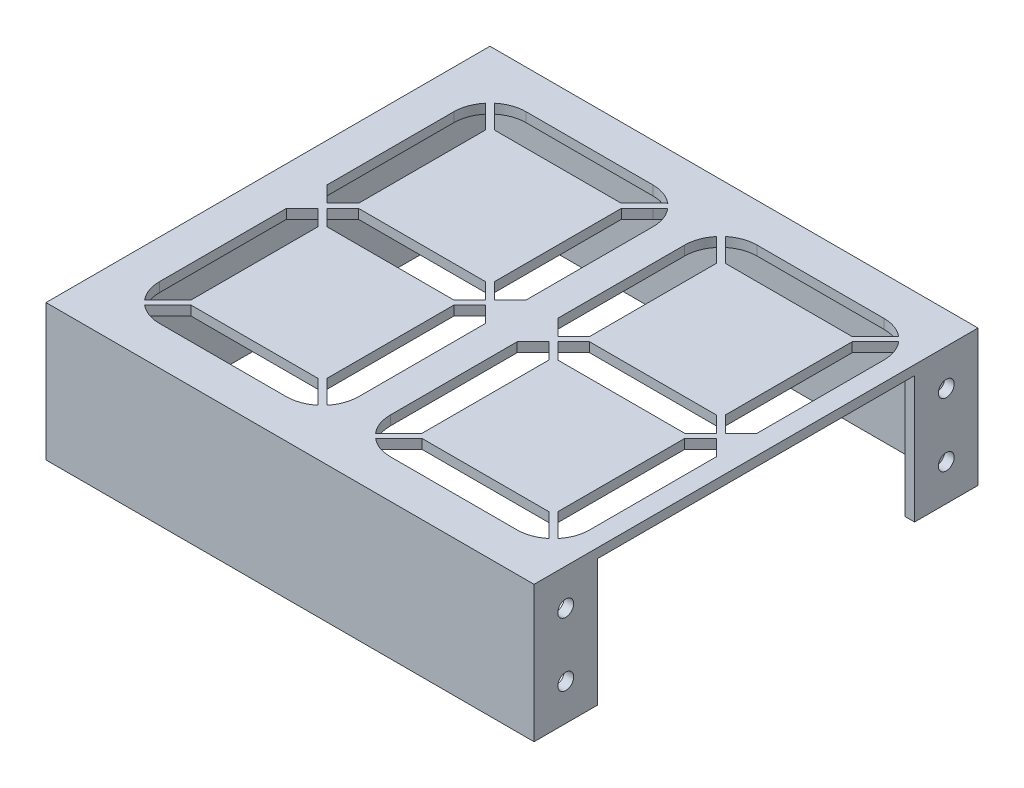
SolidWorks part; units mm, degrees
ref_plane "Alzado" through (0, 0, 0) normal (0, 0, 1) x (1, 0, 0)
ref_plane "Planta" through (0, 0, 0) normal (0, 1, 0) x (1, 0, 0)
ref_plane "Vista lateral" through (0, 0, 0) normal (1, 0, 0) x (0, 0, -1)
sketch "Croquis2" plane through (0, 0, 0) normal (0, 1, 0) x (1, 0, 0)
  line L0 (-16.41, 5) -> (-56.41, 5)
  line L2 (-11.41, 0) -> (-16.41, -5)
  line L3 (-56.41, -5) -> (-16.41, -5)
  line L4 (-16.41, 5) -> (-11.41, 0)
  line L5 (-56.41, 5) -> (-61.41, 0)
  line L6 (-61.41, 0) -> (-56.41, -5)
  line L9 (-14.9958, 6.4142) -> (-9.9958, 1.4142)
  line L11 (-4.9931, 6.41) -> (-4.9931, 46.4031)
  line L13 (-9.9958, 51.4127) -> (-14.9958, 46.4127)
  line L14 (-14.9958, 46.4127) -> (-14.9958, 6.4142)
  line L18 (-57.8242, 46.4127) -> (-57.8242, 6.4142)
  line L19 (-62.8242, 51.4127) -> (-57.8242, 46.4127)
  line L21 (-67.8235, 6.4135) -> (-67.8235, 46.4135)
  line L23 (-57.8242, 6.4142) -> (-62.8242, 1.4142)
  line L29 (-14.9958, -6.4073) -> (-9.9958, -1.4073)
  line L31 (-57.8172, -6.4142) -> (-62.8172, -1.4142)
  line L33 (-67.8165, -6.4135) -> (-67.8165, -46.4135)
  line L35 (-62.8172, -51.4127) -> (-57.8172, -46.4127)
  line L36 (-57.8172, -46.4127) -> (-57.8172, -6.4142)
  line L37 (-14.9958, -46.4058) -> (-14.9958, -6.4073)
  line L38 (-9.9958, -51.4058) -> (-14.9958, -46.4058)
  line L40 (-4.9965, -6.4135) -> (-4.9965, -46.4065)
  line L43 (-11.41, -52.82) -> (-16.41, -47.82)
  line L46 (-61.41, -52.82) -> (-56.41, -47.82)
  line L47 (-56.41, -47.82) -> (-16.41, -47.82)
  line L48 (-16.41, -57.82) -> (-56.4099, -57.82)
  line L49 (-16.4169, 47.82) -> (-11.4169, 52.82)
  line L56 (-56.4169, 47.82) -> (-61.4169, 52.82)
  line L57 (-56.4169, 57.82) -> (-16.41, 57.82)
  line L58 (-16.4169, 47.82) -> (-56.4169, 47.82)
  line L84 (-9.9958, 51.4127) -> (-7.6639, 53.7414)
  line L86 (-11.4169, 52.82) -> (-9.0786, 55.1551)
  line L88 (-61.4169, 52.82) -> (-63.7486, 55.1517)
  line L90 (-62.8242, 51.4127) -> (-65.1558, 53.7443)
  line L100 (-61.41, -52.82) -> (-63.7416, -55.1516)
  line L102 (-62.8172, -51.4127) -> (-65.1488, -53.7443)
  line L104 (-11.41, -52.82) -> (-9.0772, -55.1528)
  line L106 (-9.9958, -51.4058) -> (-7.663, -53.7385)
  line L108 (-62.8242, 1.4142) -> (-67.8235, 6.4135)
  line L109 (-62.8172, -1.4142) -> (-67.8165, -6.4135)
  line L110 (-9.9958, 1.4142) -> (-4.9931, 6.41)
  line L111 (-9.9958, -1.4073) -> (-4.9965, -6.4135)
  line L112 (-3.0433, 70) -> (-3.0433, -70) construction
  line L113 (9.9958, -1.4073) -> (4.9965, -6.4135)
  line L114 (9.9958, 1.4142) -> (4.9931, 6.41)
  line L115 (62.8172, -1.4142) -> (67.8165, -6.4135)
  line L116 (62.8242, 1.4142) -> (67.8235, 6.4135)
  line L117 (9.9958, -51.4058) -> (7.663, -53.7385)
  line L118 (11.41, -52.82) -> (9.0772, -55.1528)
  line L119 (62.8172, -51.4127) -> (65.1488, -53.7443)
  line L120 (61.41, -52.82) -> (63.7416, -55.1516)
  line L121 (62.8242, 51.4127) -> (65.1558, 53.7443)
  line L122 (61.4169, 52.82) -> (63.7486, 55.1517)
  line L123 (11.4169, 52.82) -> (9.0786, 55.1551)
  line L124 (9.9958, 51.4127) -> (7.6639, 53.7414)
  line L125 (16.4169, 47.82) -> (56.4169, 47.82)
  line L126 (56.4169, 57.82) -> (16.41, 57.82)
  line L127 (56.4169, 47.82) -> (61.4169, 52.82)
  line L128 (16.4169, 47.82) -> (11.4169, 52.82)
  line L129 (16.41, -57.82) -> (56.4099, -57.82)
  line L130 (56.41, -47.82) -> (16.41, -47.82)
  line L131 (61.41, -52.82) -> (56.41, -47.82)
  line L132 (11.41, -52.82) -> (16.41, -47.82)
  line L133 (4.9965, -6.4135) -> (4.9965, -46.4065)
  line L134 (9.9958, -51.4058) -> (14.9958, -46.4058)
  line L135 (14.9958, -46.4058) -> (14.9958, -6.4073)
  line L136 (57.8172, -46.4127) -> (57.8172, -6.4142)
  line L137 (62.8172, -51.4127) -> (57.8172, -46.4127)
  line L138 (67.8165, -6.4135) -> (67.8165, -46.4135)
  line L139 (57.8172, -6.4142) -> (62.8172, -1.4142)
  line L140 (14.9958, -6.4073) -> (9.9958, -1.4073)
  line L141 (57.8242, 6.4142) -> (62.8242, 1.4142)
  line L142 (67.8235, 6.4135) -> (67.8235, 46.4135)
  line L143 (62.8242, 51.4127) -> (57.8242, 46.4127)
  line L144 (57.8242, 46.4127) -> (57.8242, 6.4142)
  line L145 (14.9958, 46.4127) -> (14.9958, 6.4142)
  line L146 (9.9958, 51.4127) -> (14.9958, 46.4127)
  line L147 (4.9931, 6.41) -> (4.9931, 46.4031)
  line L148 (14.9958, 6.4142) -> (9.9958, 1.4142)
  line L149 (61.41, 0) -> (56.41, -5)
  line L150 (56.41, 5) -> (61.41, 0)
  line L151 (16.41, 5) -> (11.41, 0)
  line L152 (56.41, -5) -> (16.41, -5)
  line L153 (11.41, 0) -> (16.41, -5)
  line L154 (16.41, 5) -> (56.41, 5)
  line L155 (-3.0433, 0) -> (-80, 0) construction
  line L156 (-3.0433, 0) -> (73.9135, 0) construction
  line L157 (67.8235, 26.4135) -> (73.9135, 26.4135) construction
  line L158 (-80, 0) -> (-80, 70)
  line L162 (-80, -70) -> (-80, 0)
  line L163 (-80, 70) -> (73.9135, 70)
  line L164 (73.9135, 70) -> (73.9135, -70)
  line L165 (73.9135, -70) -> (-80, -70)
  arc A0 (-16.41, -57.82) -> (-9.0772, -55.1528) centre (-16.41, -46.4065) ccw
  arc A1 (-67.8165, -46.4135) -> (-65.1488, -53.7443) centre (-56.4099, -46.4134) ccw
  arc A2 (-67.8235, 46.4135) -> (-65.1558, 53.7443) centre (-56.4169, 46.4135) cw
  arc A3 (-16.41, 57.82) -> (-9.0786, 55.1551) centre (-16.41, 46.4031) cw
  arc A4 (-63.7486, 55.1517) -> (-56.4169, 57.82) centre (-56.4169, 46.4135) cw
  arc A5 (-7.6639, 53.7414) -> (-4.9931, 46.4031) centre (-16.41, 46.4031) cw
  arc A6 (-63.7416, -55.1516) -> (-56.4099, -57.82) centre (-56.4099, -46.4134) ccw
  arc A7 (-7.663, -53.7385) -> (-4.9965, -46.4065) centre (-16.41, -46.4065) ccw
  arc A8 (7.663, -53.7385) -> (4.9965, -46.4065) centre (16.41, -46.4065) cw
  arc A9 (63.7416, -55.1516) -> (56.4099, -57.82) centre (56.4099, -46.4134) cw
  arc A10 (7.6639, 53.7414) -> (4.9931, 46.4031) centre (16.41, 46.4031) ccw
  arc A11 (63.7486, 55.1517) -> (56.4169, 57.82) centre (56.4169, 46.4135) ccw
  arc A12 (16.41, 57.82) -> (9.0786, 55.1551) centre (16.41, 46.4031) ccw
  arc A13 (67.8235, 46.4135) -> (65.1558, 53.7443) centre (56.4169, 46.4135) ccw
  arc A14 (67.8165, -46.4135) -> (65.1488, -53.7443) centre (56.4099, -46.4134) cw
  arc A15 (16.41, -57.82) -> (9.0772, -55.1528) centre (16.41, -46.4065) cw
extrude "Saliente-Extruir4" add sketch "Croquis2" along normal blind 3
sketch "Croquis3" plane through (0, 0, 0) normal (0, -1, 0) x (-1, 0, 0)
  line L0 (80, -70) -> (77, -70) construction
  line L1 (80, -70) -> (-73.9135, -70)
  line L2 (80, -70) -> (80, 70)
  line L3 (80, 70) -> (-73.9135, 70)
  line L4 (-73.9135, -70) -> (-73.9135, -50)
  line L5 (77, -70) -> (77, -67) construction
  line L6 (77, -67) -> (80, -67) construction
  line L7 (-73.9135, 70) -> (-70.9135, 70) construction
  line L8 (-70.9135, 70) -> (-70.9135, 67) construction
  line L9 (-70.9135, 67) -> (-73.9135, 67) construction
  line L10 (-70.9135, 70) -> (-70.9135, 50) construction
  line L11 (-70.9135, 67) -> (77, 67)
  line L12 (-70.9135, 67) -> (-70.9135, 50)
  line L13 (-70.9135, -67) -> (77, -67)
  line L14 (77, 67) -> (77, -67)
  line L15 (-70.9135, 50) -> (-73.9135, 50)
  line L16 (-70.9135, -70) -> (-70.9135, -50) construction
  line L17 (-70.9135, -50) -> (-73.9135, -50)
  line L18 (-73.9135, 50) -> (-73.9135, 70)
  line L19 (-70.9135, -50) -> (-70.9135, -67)
extrude "Saliente-Extruir5" add sketch "Croquis3" along normal blind 40
sketch "Croquis4" plane through (73.9135, 0, 0) normal (1, 0, 0) x (0, 0, -1)
  line L0 (-70, -18.5) -> (-60, -18.5) construction
  line L1 (-70, 3) -> (-70, -40) construction
  line L2 (-60, -18.5) -> (-60, -8.5) construction
  line L3 (-60, -18.5) -> (-60, -28.5) construction
  line L4 (70, -18.5) -> (60, -18.5) construction
  line L5 (70, 3) -> (70, -40) construction
  line L6 (60, -18.5) -> (60, -8.5) construction
  line L7 (60, -18.5) -> (60, -28.5) construction
  circle A0 centre (-60, -8.5) radius 2.5
  circle A1 centre (-60, -28.5) radius 2.5
  circle A2 centre (60, -8.5) radius 2.5
  circle A3 centre (60, -28.5) radius 2.5
extrude "Cortar-Extruir2" cut sketch "Croquis4" against normal blind 3
sketch "Croquis6" plane through (0, -40, 0) normal (0, -1, 0) x (1, 0, 0)
  line L0 (-77, 67) -> (-69, 67)
  line L1 (-77, 67) -> (70.9135, 67) construction
  line L2 (-77, 67) -> (-77, 59)
  line L3 (-77, -67) -> (-77, 67) construction
  line L4 (-77, 59) -> (-69, 67)
  line L5 (70.9135, 67) -> (62.9135, 67)
  line L6 (70.9135, 67) -> (70.9135, 59)
  line L7 (70.9135, 67) -> (70.9135, 50) construction
  line L8 (70.9135, 59) -> (62.9135, 67)
  line L9 (70.9135, -67) -> (70.9135, -58.5)
  line L10 (70.9135, -67) -> (62.9135, -67)
  line L11 (70.9135, -50) -> (70.9135, -67) construction
  line L12 (70.9135, -67) -> (-77, -67) construction
  line L13 (62.9135, -67) -> (70.9135, -58.5)
  line L14 (-77, -67) -> (-69, -67)
  line L15 (-77, -67) -> (-77, -59)
  line L16 (-77, -67) -> (-77, 67) construction
  line L17 (-77, -59) -> (-69, -67)
  line L18 (-3.0433, 67) -> (-7.0433, 67)
  line L19 (-77, 67) -> (70.9135, 67) construction
  line L20 (-3.0433, 67) -> (0.9567, 67)
  line L21 (-7.0433, 67) -> (-7.0433, 59)
  line L22 (-7.0433, 59) -> (0.9567, 59)
  line L23 (0.9567, 59) -> (0.9567, 67)
  line L24 (-3.0433, -67) -> (-7.0433, -67)
  line L25 (70.9135, -67) -> (-77, -67) construction
  line L26 (-7.0433, -67) -> (-7.0433, -59)
  line L27 (-7.0433, -59) -> (0.9567, -59)
  line L28 (0.9567, -59) -> (0.9567, -67)
  line L29 (0.9567, -67) -> (-7.0433, -67)
  line L31 (-80, -10) -> (-95, -10)
  line L36 (-77, 4) -> (-69, 4)
  line L37 (-69, 4) -> (-69, -4)
  line L38 (-69, -4) -> (-77, -4)
  line L39 (-80, 0) -> (-80, 10)
  line L40 (-80, 70) -> (-80, -70) construction
  line L41 (-80, 0) -> (-80, -10)
  line L42 (-77, -59) -> (-77, 67) construction
  line L43 (-95, -10) -> (-95, 10)
  line L44 (-95, 10) -> (-80, 10)
  line L45 (-77, 4) -> (-77, -4)
  line L46 (-77, 67) -> (70.9135, 67) construction
  line L47 (70.9135, -67) -> (70.9135, 67) construction
  line L48 (70.9135, -67) -> (-77, -67) construction
  line L49 (-80, 10) -> (-95, -10) construction
  line L50 (-80, -10) -> (-95, 10) construction
extrude "Saliente-Extruir8" add sketch "Croquis6" against normal blind 3 contours L44 L43 L31 M10 | L17 M16 M15 | L13 M15 M14 | L38 L37 L36 M16 | L4 M16 M17 | L22 L23 L21 M17 | L8 M18 M17 | L26 L27 L28 L29
sketch "Croquis7" plane through (0, -40, 0) normal (0, -1, 0) x (1, 0, 0)
  line L0 (-3.0433, -59) -> (-3.0433, -63) construction
  line L1 (-7.0433, -59) -> (0.9567, -59) construction
  line L2 (-77, -59) -> (-77, -67) construction
  line L3 (-77, -59) -> (-69, -67) construction
  line L4 (-77, -67) -> (-69, -67) construction
  line L5 (-77, -67) -> (-73, -63) construction
  line L6 (-73, 63) -> (-77, 67) construction
  line L7 (-77, 59) -> (-69, 67) construction
  line L8 (66.9135, 63) -> (71.8882, 67) construction
  line L9 (70.9135, 59) -> (62.9135, 67) construction
  line L10 (66.9135, -62.75) -> (71.8882, -67.4321) construction
  line L11 (62.9135, -67) -> (70.9135, -58.5) construction
  line L12 (-80, 10) -> (-87.5, 10) construction
  line L13 (-95, 10) -> (-80, 10) construction
  line L14 (-87.5, 10) -> (-87.5, -10) construction
  line L15 (-80, -10) -> (-95, -10) construction
  line L16 (-87.5, -10) -> (-80, -10) construction
  line L17 (-95, -10) -> (-95, 10) construction
  line L18 (-95, -2.5) -> (-95, -10)
  line L19 (-95, -10) -> (-87.5, -10)
  line L20 (-95, 2.5) -> (-95, 10)
  line L21 (-95, 10) -> (-87.5, 10)
  circle A0 centre (-3.0433, -63) radius 1.25
  circle A1 centre (-75, -65) radius 1.25
  circle A2 centre (-73, 0) radius 1.25
  circle A3 centre (-75, 65) radius 1.25
  circle A4 centre (69.4008, 65) radius 1.25
  circle A5 centre (69.4008, -65.0911) radius 1.25
  circle A6 centre (-87.5, 0) radius 3
  arc A7 (-87.5, 10) -> (-95, 2.5) centre (-87.5, 2.5) ccw
  arc A8 (-87.5, -10) -> (-95, -2.5) centre (-87.5, -2.5) cw
  circle A9 centre (-3.0433, 63) radius 1.25
extrude "Cortar-Extruir4" cut sketch "Croquis7" against normal blind 3
fillet "Redondeo2" radius 3 6 edges at (-69, -38.5, -4) (-69, -38.5, 4) (0.9567, -38.5, -59) (-7.0433, -38.5, -59) (-7.0433, -38.5, 59) (0.9567, -38.5, 59)
sketch "Croquis8" plane through (0, -37, 0) normal (0, 1, 0) x (1, 0, 0)
  line L0 (-80, 10) -> (-86, 10)
  line L1 (-80, 10) -> (-87.5, 10) construction
  line L2 (-86, 10) -> (-86, 8)
  line L3 (-86, 8) -> (-80, 8)
  line L4 (-80, 70) -> (-80, -70) construction
  line L5 (-80, 8) -> (-80, 10)
  line L6 (-80, -10) -> (-86, -10)
  line L7 (-87.5, -10) -> (-80, -10) construction
  line L8 (-86, -10) -> (-86, -8)
  line L9 (-86, -8) -> (-80, -8)
  line L10 (-80, -10) -> (-80, 10) construction
  line L11 (-80, -8) -> (-80, -10)
extrude "Saliente-Extruir9" add sketch "Croquis8" along normal blind 6
sketch "Croquis9" plane through (0, 0, 10) normal (0, 0, 1) x (1, 0, 0)
  line L0 (-86, -37) -> (-80, -31)
  line L1 (-80, 3) -> (-80, -40) construction
  line L2 (-80, -31) -> (-80, -40) construction
  line L3 (-80, -31) -> (-86, -31)
  line L4 (-86, -31) -> (-86, -37)
extrude "Cortar-Extruir5" cut sketch "Croquis9" against normal blind 20
sketch "Croquis10" plane through (-80, 0, 0) normal (-1, 0, 0) x (0, 0, 1)
  line L0 (-70, -40) -> (-70, -35) construction
  line L1 (-70, 3) -> (-70, -40) construction
  line L2 (-70, -35) -> (-70, -32) construction
  line L3 (-70, -32) -> (-62, -32) construction
  circle A1 centre (-62, -32) radius 3.5
extrude "Cortar-Extruir7" cut sketch "Croquis10" against normal blind 3
